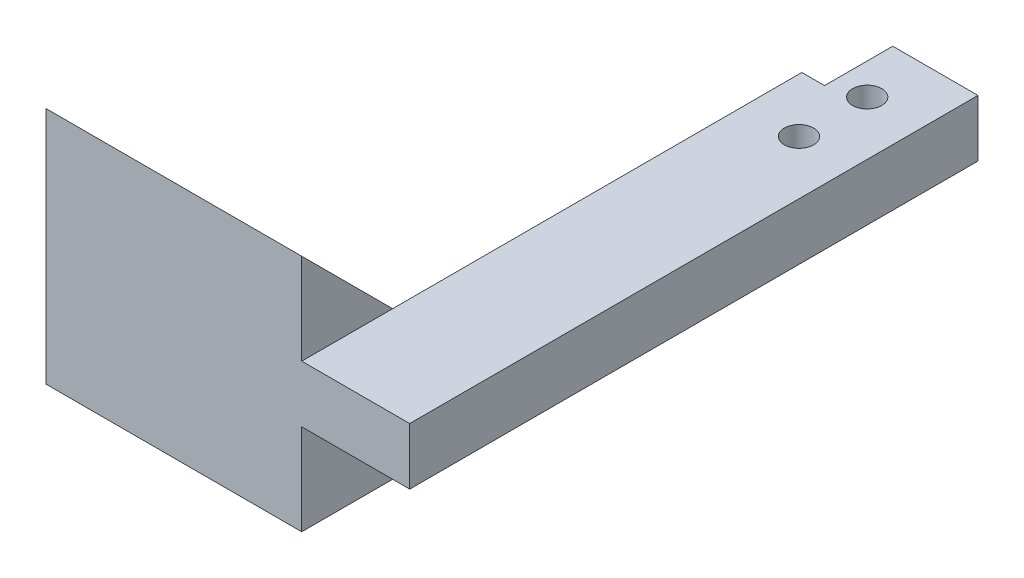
SolidWorks part; units mm, degrees
ref_plane "Front Plane" through (0, 0, 0) normal (0, 0, 1) x (1, 0, 0)
ref_plane "Top Plane" through (0, 0, 0) normal (0, 1, 0) x (1, 0, 0)
ref_plane "Right Plane" through (0, 0, 0) normal (1, 0, 0) x (0, 0, -1)
sketch "Sketch1" plane through (0, 0, 0) normal (0, 1, 0) x (1, 0, 0)
  line L1 (-6.0325, -31.75) -> (6.0325, -31.75)
  line L2 (-6.0325, -31.75) -> (-6.0325, 31.75)
  line L3 (-6.0325, 31.75) -> (6.0325, 31.75)
  line L4 (6.0325, -31.75) -> (6.0325, 31.75)
  line L5 (-6.0325, -31.75) -> (6.0325, 31.75) construction
  line L6 (-6.0325, 31.75) -> (6.0325, -31.75) construction
  point P0 (0, 0)
  dimension "D1" = 12.065
  dimension "D2" = 63.5
extrude "Boss-Extrude1" add sketch "Sketch1" along normal blind 6.35
sketch "Sketch5" plane through (0, 6.35, 0) normal (0, 1, 0) x (1, 0, 0)
  line L1 (-6.0325, 31.75) -> (-3.4925, 31.75)
  line L2 (-6.0325, 31.75) -> (-6.0325, 24.13)
  line L3 (-6.0325, 24.13) -> (-3.4925, 24.13)
  line L4 (-3.4925, 31.75) -> (-3.4925, 24.13)
  dimension "D1" = 2.54
  dimension "D2" = 7.62
extrude "Cut-Extrude1" cut sketch "Sketch5" against normal through all
sketch "Sketch6" plane through (-6.0325, 0, 0) normal (-1, 0, 0) x (0, 0, 1)
  line L0 (31.75, 0) -> (31.75, 6.35)
  line L1 (31.75, 6.35) -> (31.75, 16.51)
  line L2 (31.75, 16.51) -> (5.08, -10.16)
  line L3 (5.08, -10.16) -> (31.75, -10.16)
  line L4 (31.75, -10.16) -> (31.75, 0)
  dimension "D1" = 10.16
  dimension "D2" = 45
  dimension "D3" = 10.16
extrude "Boss-Extrude3" add sketch "Sketch6" along normal blind 28.575
hole_wizard "#30 (0.1285) Diameter Hole1" positions "Sketch7" profile "Sketch8" hole size "#30" standard "ANSI Inch"
sketch "Sketch7" plane through (0, 6.35, 0) normal (0, 1, 0) x (1, 0, 0)
  line L0 (6.0325, -31.75) -> (6.0325, 31.75) construction
  line L1 (6.0325, 31.75) -> (-3.4925, 31.75) construction
  point P0 (0, 25.4)
  point P2 (0, 17.78)
  dimension "D1" = 6.0325
  dimension "D2" = 6.0325
  dimension "D3" = 7.62
  dimension "D4" = 6.35
sketch "Sketch8" plane through (0, 6.35, -25.4) normal (1, 0, 0) x (0, 0, 1)
  line L0 (0, 0) -> (0, 16.51)
  line L1 (0, 16.51) -> (1.6319, 16.51)
  line L2 (1.6319, 16.51) -> (1.6319, 0)
  line L5 (1.6319, 0) -> (0, 0)
  line L11 (0, -6.35) -> (0, 107.95) construction
  dimension "Thru Hole Dia." = 3.2639
  dimension "Thru Hole Depth" = 16.51
